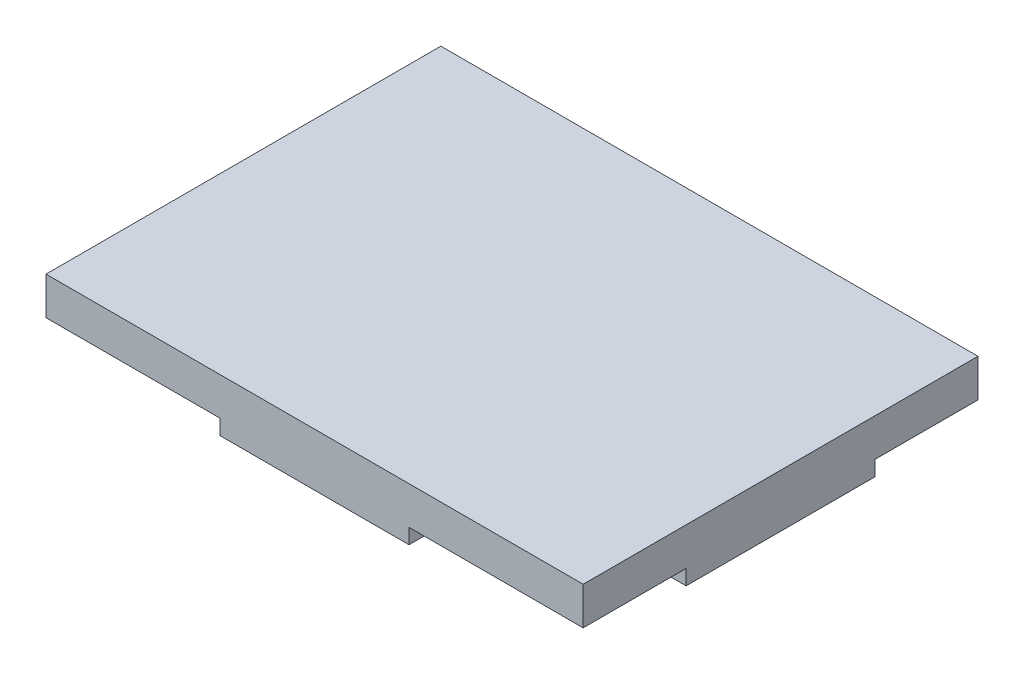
SolidWorks part; units mm, degrees
ref_plane "Front Plane" through (0, 0, 0) normal (0, 0, 1) x (1, 0, 0)
ref_plane "Top Plane" through (0, 0, 0) normal (0, 1, 0) x (1, 0, 0)
ref_plane "Right Plane" through (0, 0, 0) normal (1, 0, 0) x (0, 0, -1)
surface "Surface-Radiate1" parameters "D1"=20
surface "Surface-Knit1"
ref_plane "Plane1" through (0, 5, 0) normal (0, 1, 0) x (1, 0, 0)
sketch "Sketch2" plane through (0, 5, 0) normal (0, 1, 0) x (1, 0, 0)
  line L0 (-35.5445, -26.1282) -> (35.5445, -26.1282) construction
  line L1 (-35.5445, 26.1282) -> (-35.5445, -26.1282) construction
  line L2 (-35.5445, 26.1282) -> (35.5445, 26.1282) construction
  line L3 (35.5445, 26.1282) -> (35.5445, -26.1282) construction
  line L4 (-35.5445, -26.1282) -> (35.5445, -26.1282)
  line L5 (-35.5445, 26.1282) -> (-35.5445, -26.1282)
  line L6 (-35.5445, 26.1282) -> (35.5445, 26.1282)
  line L7 (35.5445, 26.1282) -> (35.5445, -26.1282)
extrude "Boss-Extrude1" add sketch "Sketch2" against normal up to surface (5 mm away)
